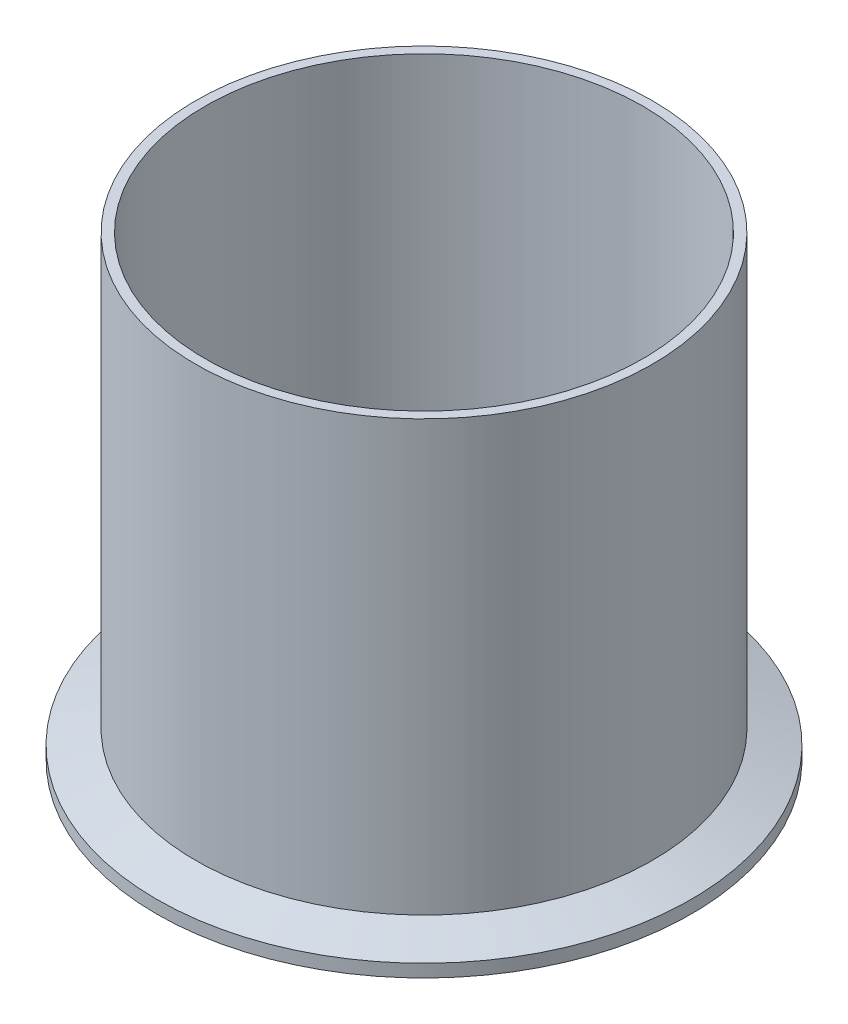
SolidWorks part; units mm, degrees
ref_plane "Front Plane" through (0, 0, 0) normal (0, 0, 1) x (1, 0, 0)
ref_plane "Top Plane" through (0, 0, 0) normal (0, 1, 0) x (1, 0, 0)
ref_plane "Right Plane" through (0, 0, 0) normal (1, 0, 0) x (0, 0, -1)
sketch "Sketch1" plane through (0, 0, 0) normal (0, 0, 1) x (1, 0, 0)
  line L0 (0, 0) -> (0, 101.6) construction
  line L1 (0, 101.6) -> (-50.8, 101.6)
  line L2 (-50.8, 101.6) -> (-50.8, 5.9973)
  line L3 (-50.8, 5.9973) -> (-59.4614, 2.8448)
  line L4 (-59.4614, 2.8448) -> (-59.4614, 0)
  line L5 (-59.4614, 0) -> (-56.6185, 0)
  line L6 (-52.9825, 0) -> (0, 0)
  line L7 (0, 0) -> (0, 101.6)
  line L8 (0, 101.6) -> (-48.6918, 101.6)
  line L9 (-48.6918, 101.6) -> (-48.6918, 0)
  line L10 (-48.6918, 0) -> (0, 0)
  line L11 (0, 0) -> (-0.1846, 0.0129)
  arc A0 (-55.896, 0.4745) -> (-53.705, 0.4745) centre (-54.8005, 0) cw
  arc A1 (-52.9825, 0) -> (-53.705, 0.4745) centre (-52.9825, 0.7874) cw
  arc A2 (-55.896, 0.4745) -> (-56.6185, 0) centre (-56.6185, 0.7874) cw
  point P12 (-53.6067, 0)
  dimension "D6" = 1.1938
  dimension "D7" = 0.7874
  dimension "D1" = 50.8
  dimension "D2" = 2.8448
  dimension "D3" = 59.4614
  dimension "D4" = 70
  dimension "D5" = 54.8005
  dimension "D8" = 2.1082
  dimension "D9" = 101.6
revolve "Revolve2" add sketch "Sketch1" angle 360 about L0
